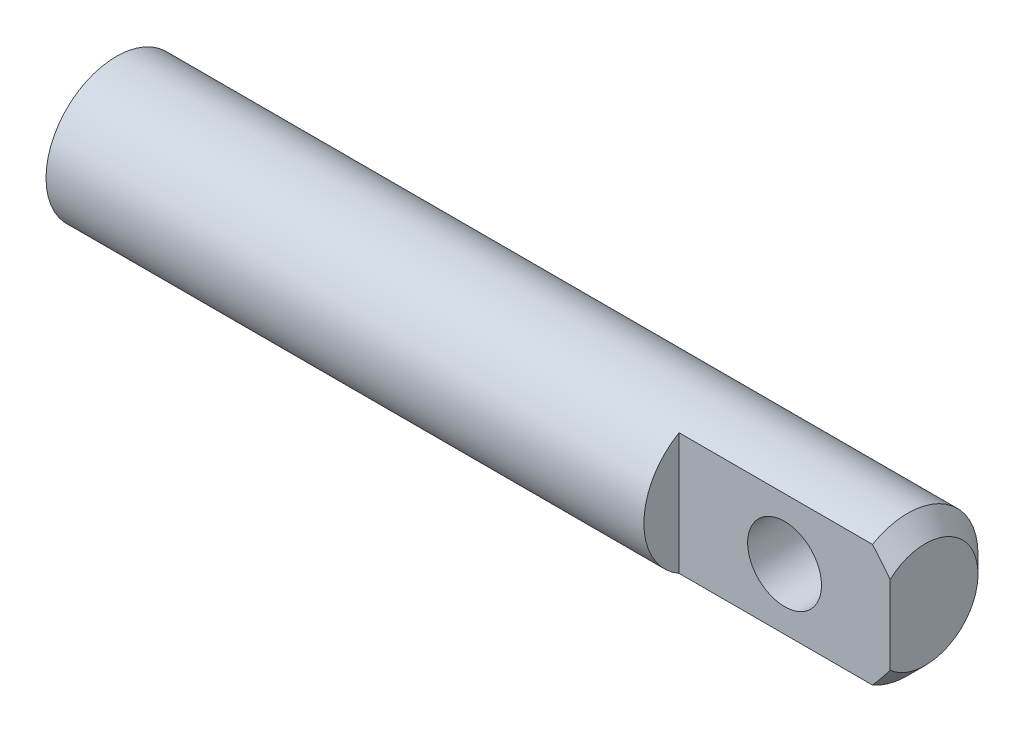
SolidWorks part; units mm, degrees
ref_plane "Front Plane" through (0, 0, 0) normal (0, 0, 1) x (1, 0, 0)
ref_plane "Top Plane" through (0, 0, 0) normal (0, 1, 0) x (1, 0, 0)
ref_plane "Right Plane" through (0, 0, 0) normal (1, 0, 0) x (0, 0, -1)
sketch "Sketch1" plane through (0, 0, 0) normal (0, 0, 1) x (1, 0, 0)
  line L0 (0, 0) -> (23, 0) construction
  line L1 (0, 0) -> (0, 2)
  line L2 (0, 2) -> (22.5, 2)
  line L3 (23, 1.5) -> (23, 0)
  line L4 (0, 0) -> (23, 0)
  line L6 (22.5, 2) -> (23, 1.5)
  point P3 (0, 2)
  point P5 (23, 2)
  dimension "A" = 23
  dimension "D2" = 4
revolve "Revolve1" add sketch "Sketch1" angle 360 about L0
sketch "Sketch4" plane through (23, 0, 0) normal (1, 0, 0) x (0, 0, -1)
  line L0 (-1, 1.7321) -> (-1, -1.7321)
  arc A0 (-1, 1.7321) -> (-1, -1.7321) centre (0, 0) ccw
  circle A1 centre (0, 0) radius 2 construction
  dimension "D1" = 3
extrude "Cut-Extrude3" cut sketch "Sketch4" against normal blind 6
sketch "Sketch5" plane through (0, 0, 1) normal (0, 0, 1) x (1, 0, 0)
  line L0 (23, 1.118) -> (23, -1.118) construction
  circle A0 centre (20, 0) radius 1.05
  dimension "D2" = 2.1
  dimension "D1" = 3
extrude "Cut-Extrude4" cut sketch "Sketch5" against normal through all
